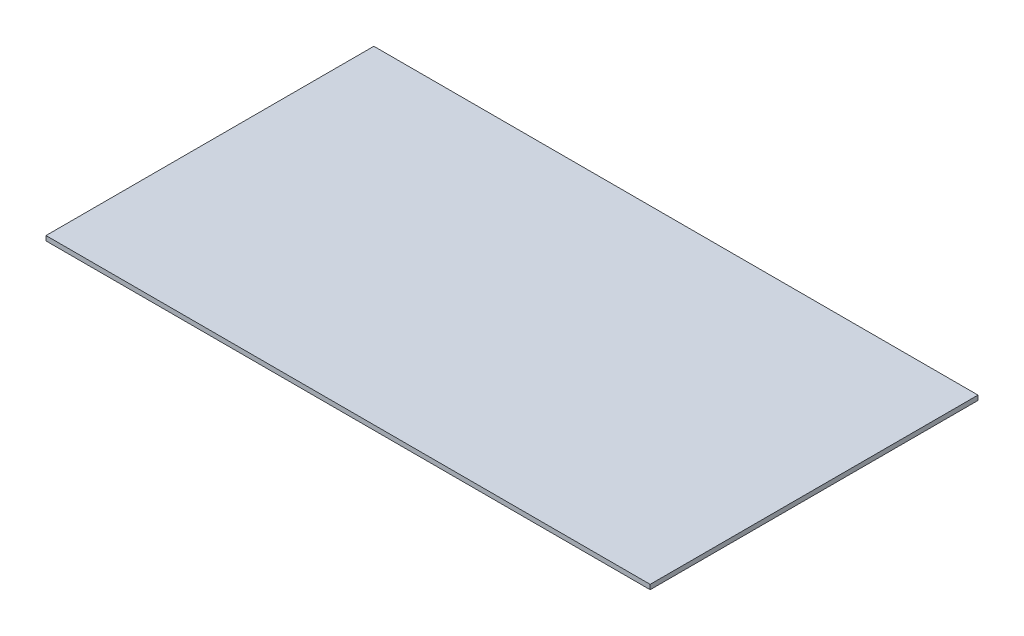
SolidWorks part; units mm, degrees
ref_plane "Front" through (0, 0, 0) normal (0, 0, 1) x (1, 0, 0)
ref_plane "Top" through (0, 0, 0) normal (0, 1, 0) x (1, 0, 0)
ref_plane "Right" through (0, 0, 0) normal (1, 0, 0) x (0, 0, -1)
sketch "Sketch1" plane through (0, 0, 0) normal (0, 0, 1) x (1, 0, 0)
  line L1 (-322.5, -60) -> (322.5, -60)
  line L2 (-322.5, -60) -> (-322.5, -55)
  line L3 (-322.5, -55) -> (322.5, -55)
  line L4 (322.5, -60) -> (322.5, -55)
extrude "Base-Extrude" add sketch "Sketch1" along normal up to surface (350 mm away)
